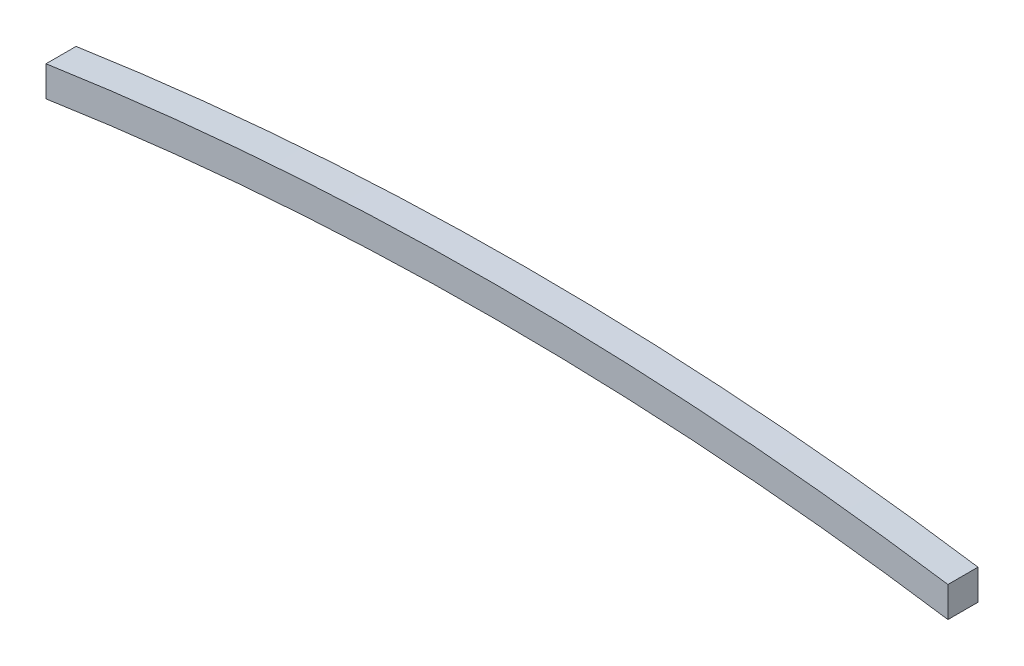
SolidWorks part; units mm, degrees
ref_plane "Ebene vorne" through (0, 0, 0) normal (0, 0, 1) x (1, 0, 0)
ref_plane "Ebene oben" through (0, 0, 0) normal (0, 1, 0) x (1, 0, 0)
ref_plane "Ebene rechts" through (0, 0, 0) normal (1, 0, 0) x (0, 0, -1)
sketch "Skizze1" plane through (0, 0, 0) normal (0, 0, 1) x (1, 0, 0)
  line L0 (0, 0) -> (0, 50.5664)
  line L1 (0, 0) -> (1500, 0) construction
  line L2 (750, 0) -> (750, -1054.9671) construction
  line L3 (49.4817, 57.7473) -> (49.4817, 57.7473)
  line L4 (1500, 0) -> (1500, 50.5664)
  line L5 (650, 105.5798) -> (650, 855.0296) construction
  arc A0 (1500, 0) -> (0, 0) centre (750, -4943.43) ccw
  arc A1 (1500, 50.5664) -> (0, 50.5664) centre (750, -4943.43) ccw
  arc A2 (1507.5, 49.4343) -> (49.4817, 57.7473) centre (750, -4943.43) ccw construction
  dimension "D2" = 5000
  dimension "D1" = 1500
  dimension "D4" = 650
  dimension "D3" = 50
extrude "Linear austragen1" add sketch "Skizze1" against normal blind 50
equation "\"LÄNGE\"=0"
equation "\"BREITE\"=0"
equation "\"HÖHE\"=0"
equation "\"DURCHMESSER\"=0"
equation "\"Stückzahl\"= 1"
